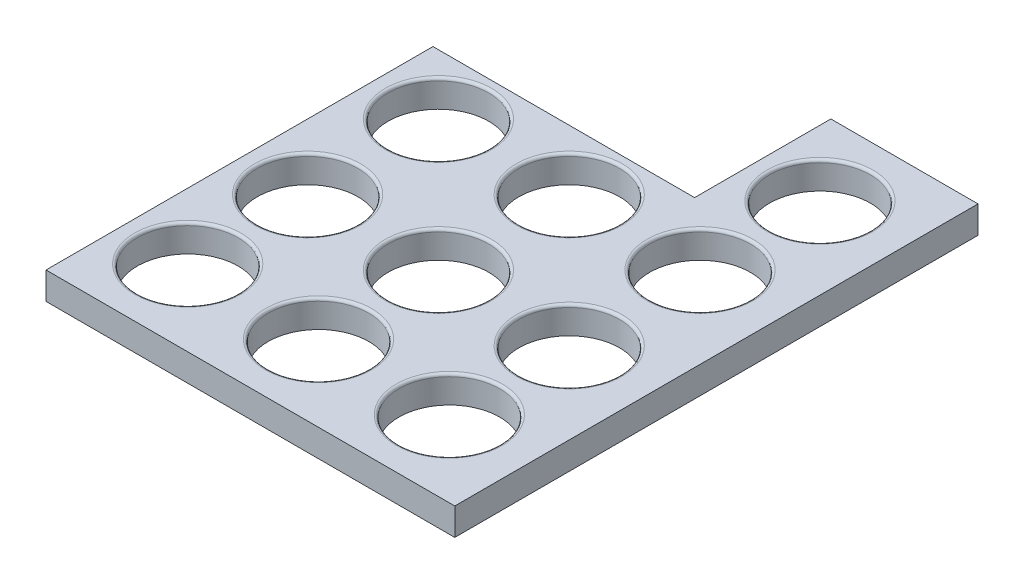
SolidWorks part; units mm, degrees
ref_plane "Front Plane" through (0, 0, 0) normal (0, 0, 1) x (1, 0, 0)
ref_plane "Top Plane" through (0, 0, 0) normal (0, 1, 0) x (1, 0, 0)
ref_plane "Right Plane" through (0, 0, 0) normal (1, 0, 0) x (0, 0, -1)
sketch "Sketch1" plane through (0, 0, 0) normal (0, 1, 0) x (1, 0, 0)
  line L1 (-63, 48) -> (63, 48)
  line L2 (-63, 48) -> (-63, -48)
  line L3 (-63, -48) -> (63, -48)
  line L4 (63, 48) -> (63, -48)
  line L5 (-63, 48) -> (63, -48) construction
  line L6 (-63, -48) -> (63, 48) construction
  circle A0 centre (0, 34) radius 9.25
  circle A1 centre (0, 12) radius 9.25
  circle A2 centre (0, -12) radius 9.25
  circle A3 centre (0, -34) radius 9.25
  circle A4 centre (24, -34) radius 9.25
  circle A5 centre (24, -12) radius 9.25
  circle A6 centre (24, 12) radius 9.25
  circle A7 centre (24, 34) radius 9.25
  circle A8 centre (48, -34) radius 9.25
  circle A9 centre (48, -12) radius 9.25
  circle A10 centre (48, 12) radius 9.25
  circle A11 centre (48, 34) radius 9.25
  circle A12 centre (0, -34) radius 9.25
  circle A13 centre (0, -12) radius 9.25
  circle A14 centre (0, 12) radius 9.25
  circle A15 centre (0, 34) radius 9.25
  circle A16 centre (24, -34) radius 9.25
  circle A17 centre (24, -12) radius 9.25
  circle A18 centre (24, 12) radius 9.25
  circle A19 centre (24, 34) radius 9.25
  circle A20 centre (-24, -34) radius 9.25
  circle A21 centre (-24, -12) radius 9.25
  circle A22 centre (-24, 12) radius 9.25
  circle A23 centre (-24, 34) radius 9.25
  circle A24 centre (0, -34) radius 9.25
  circle A25 centre (0, -12) radius 9.25
  circle A26 centre (0, 12) radius 9.25
  circle A27 centre (0, 34) radius 9.25
  circle A28 centre (-24, -34) radius 9.25
  circle A29 centre (-24, -12) radius 9.25
  circle A30 centre (-24, 12) radius 9.25
  circle A31 centre (-24, 34) radius 9.25
  circle A32 centre (-48, -34) radius 9.25
  circle A33 centre (-48, -12) radius 9.25
  circle A34 centre (-48, 12) radius 9.25
  circle A35 centre (-48, 34) radius 9.25
  point P0 (0, 0)
  dimension "D1" = 12
  dimension "D2" = 34
  dimension "D3" = 34
  dimension "D4" = 48
  dimension "D5" = 3
  dimension "D6" = 3
  dimension "D7" = 126
extrude "Boss-Extrude1" add sketch "Sketch1" along normal blind 5 contours L4 L1 L2 L3 A35 A34 A33 A32 A23 A22 A21 A20 A11 A10 A9 A8 A7 A6 A5 A4 A3 A2 A1 A0
fillet "Fillet1" radius 0.5 18 edges at (48, 5, 43.25) (24, 5, 43.25) (24, 5, 21.25) (48, 5, 21.25) (24, 5, -2.75) (48, 5, -2.75) (48, 5, -24.75) (24, 5, -24.75) (0, 5, -24.75) (0, 5, -2.75) (0, 5, 21.25) (0, 5, 43.25) (-24, 5, 21.25) (-24, 5, 43.25) (-48, 5, 43.25) (-48, 5, 21.25) (-48, 5, -2.75) (-48, 5, -24.75)
sketch "Sketch2" plane through (0, 5, 0) normal (0, 1, 0) x (1, 0, 0)
  line L0 (36, 48) -> (36, 23)
  line L1 (-63, 48) -> (63, 48) construction
  line L2 (36, 23) -> (-12, 23)
  line L3 (-12, 23) -> (-12, -48)
  line L4 (-63, -48) -> (63, -48) construction
  line L5 (-12, -48) -> (-63, -48)
  line L6 (-63, -48) -> (-63, 48)
  line L7 (-63, 48) -> (36, 48)
  line L8 (63, 48) -> (63, -48) construction
  dimension "D1" = 27
  dimension "D2" = 25
  dimension "D3" = 75
extrude "Cut-Extrude1" cut sketch "Sketch2" against normal blind 10
